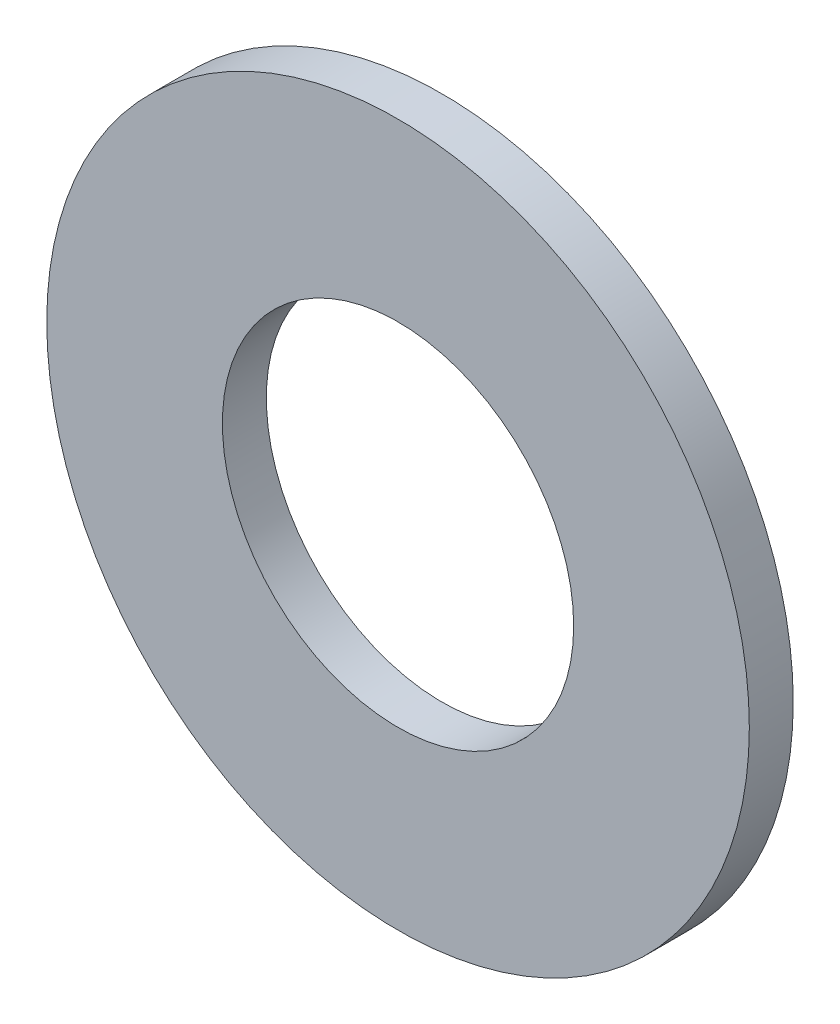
SolidWorks part; units mm, degrees
ref_plane "Плоскость1" through (0, 0, 0) normal (0, 0, 1) x (1, 0, 0)
ref_plane "Плоскость2" through (0, 0, 0) normal (0, 1, 0) x (1, 0, 0)
ref_plane "Плоскость3" through (0, 0, 0) normal (1, 0, 0) x (0, 0, -1)
sketch "Эскиз1" plane through (0, 0, 0) normal (0, 0, 1) x (1, 0, 0)
  circle A0 centre (-10, -20) radius 4
  circle A1 centre (-10, -20) radius 8
  dimension "D1" = 8
  dimension "D2" = 16
extrude "Основание-Вытянуть" add sketch "Эскиз1" along normal blind 1
